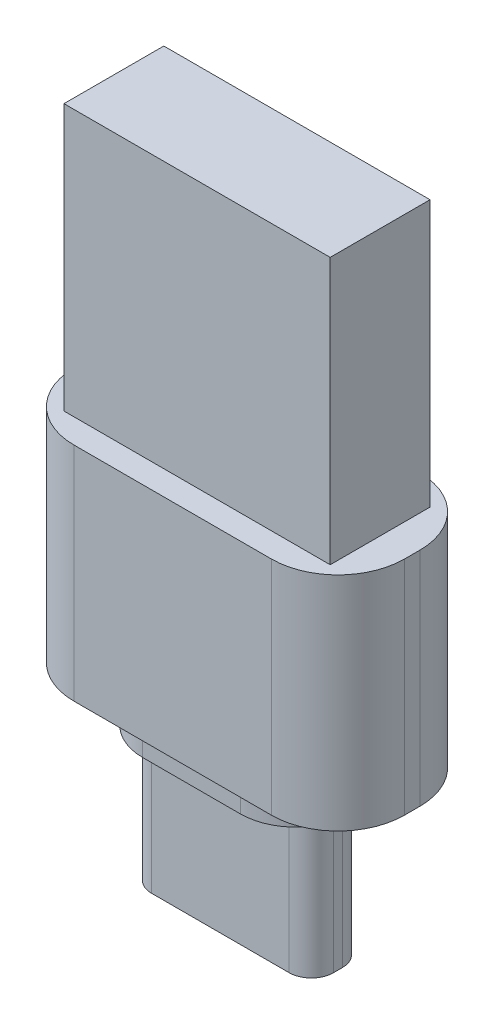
SolidWorks part; units mm, degrees
ref_plane "Alzado" through (0, 0, 0) normal (0, 0, 1) x (1, 0, 0)
ref_plane "Planta" through (0, 0, 0) normal (0, 1, 0) x (1, 0, 0)
ref_plane "Vista lateral" through (0, 0, 0) normal (1, 0, 0) x (0, 0, -1)
sketch "Croquis1" plane through (0, 0, 0) normal (0, 1, 0) x (1, 0, 0)
  line L2 (-7.45, -3.35) -> (7.45, -3.35)
  line L3 (-7.45, -3.35) -> (-7.45, 3.35)
  line L4 (-7.45, 3.35) -> (7.45, 3.35)
  line L5 (7.45, -3.35) -> (7.45, 3.35)
  line L6 (-7.45, -3.35) -> (7.45, 3.35) construction
  line L7 (-7.45, 3.35) -> (7.45, -3.35) construction
  point P2 (0, 0)
  dimension "D1" = 6.7
  dimension "D2" = 14.9
extrude "Saliente-Extruir1" add sketch "Croquis1" along normal blind 10
sketch "Croquis2" plane through (0, 10, 0) normal (0, 1, 0) x (1, 0, 0)
  line L1 (-6, -2.25) -> (6, -2.25)
  line L2 (-6, -2.25) -> (-6, 2.25)
  line L3 (-6, 2.25) -> (6, 2.25)
  line L4 (6, -2.25) -> (6, 2.25)
  line L5 (-6, -2.25) -> (6, 2.25) construction
  line L6 (-6, 2.25) -> (6, -2.25) construction
  point P0 (0, 0)
  dimension "D1" = 12
  dimension "D2" = 4.5
extrude "Saliente-Extruir2" add sketch "Croquis2" along normal blind 12
sketch "Croquis3" plane through (0, 0, 0) normal (0, -1, 0) x (1, 0, 0)
  line L1 (4.7, 2.5) -> (-4.7, 2.5)
  line L2 (4.7, 2.5) -> (4.7, -2.5)
  line L3 (4.7, -2.5) -> (-4.7, -2.5)
  line L4 (-4.7, 2.5) -> (-4.7, -2.5)
  line L5 (4.7, 2.5) -> (-4.7, -2.5) construction
  line L6 (4.7, -2.5) -> (-4.7, 2.5) construction
  point P0 (0, 0)
  dimension "D1" = 5
  dimension "D2" = 9.4
extrude "Saliente-Extruir3" add sketch "Croquis3" along normal blind 1.5
sketch "Croquis4" plane through (0, -1.5, 0) normal (0, -1, 0) x (1, 0, 0)
  line L1 (4.1, 1.2) -> (-4.1, 1.2)
  line L2 (4.1, 1.2) -> (4.1, -1.2)
  line L3 (4.1, -1.2) -> (-4.1, -1.2)
  line L4 (-4.1, 1.2) -> (-4.1, -1.2)
  line L5 (4.1, 1.2) -> (-4.1, -1.2) construction
  line L6 (4.1, -1.2) -> (-4.1, 1.2) construction
  point P0 (0, 0)
  dimension "D1" = 8.2
  dimension "D2" = 2.4
extrude "Saliente-Extruir4" add sketch "Croquis4" along normal blind 6.4
fillet "Redondeo1" radius 3 4 edges at (7.45, 5, 3.35) (-7.45, 5, 3.35) (-7.45, 5, -3.35) (7.45, 5, -3.35)
fillet "Redondeo2" radius 2.5 4 edges at (-4.7, -0.75, -2.5) (-4.7, -0.75, 2.5) (4.7, -0.75, 2.5) (4.7, -0.75, -2.5)
fillet "Redondeo3" radius 1 4 edges at (4.1, -4.7, -1.2) (4.1, -4.7, 1.2) (-4.1, -4.7, 1.2) (-4.1, -4.7, -1.2)
